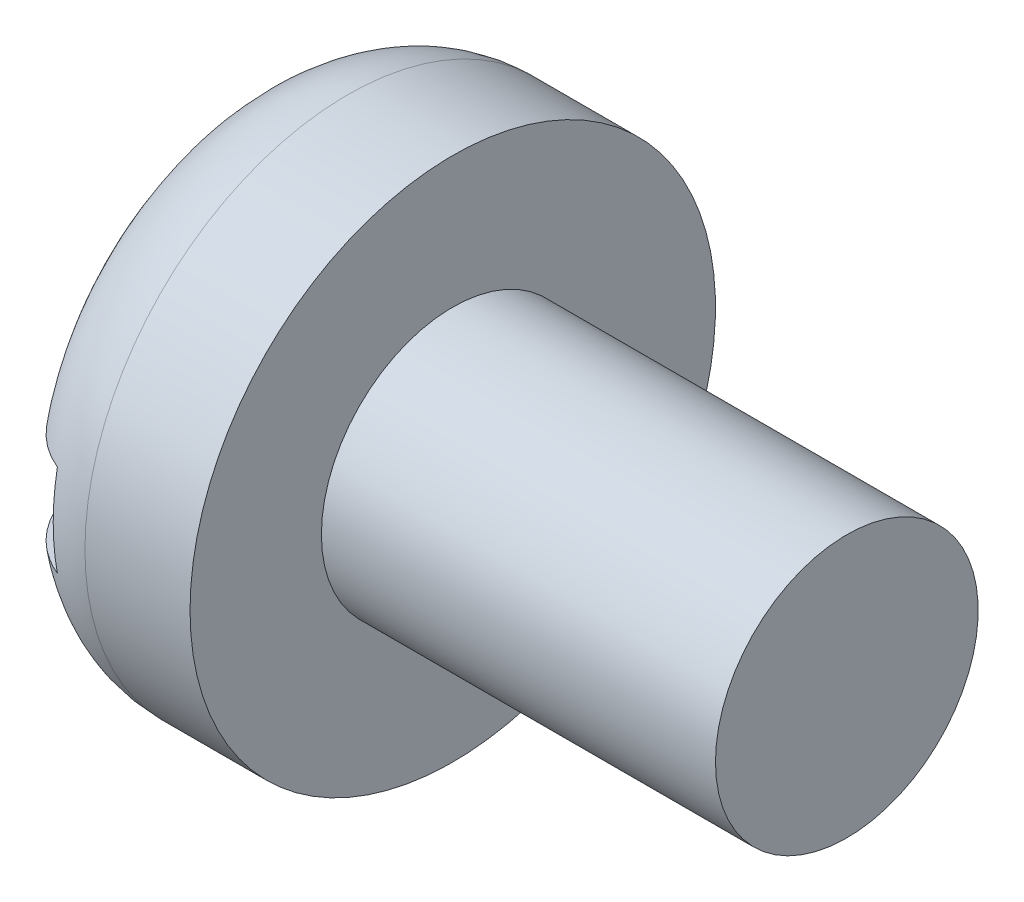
SolidWorks part; units mm, degrees
ref_plane "Plane1" through (0, 0, 0) normal (0, 0, 1) x (1, 0, 0)
ref_plane "Plane2" through (0, 0, 0) normal (0, 1, 0) x (1, 0, 0)
ref_plane "Plane3" through (0, 0, 0) normal (1, 0, 0) x (0, 0, -1)
revolve "Base-Revolve" add sketch "BodySke" angle 360 about L2
sketch "BodySke" plane through (0, 0, 0) normal (0, 0, 1) x (1, 0, 0)
  line L0 (1.6, 1) -> (1.6, 2)
  line L1 (0, 0) -> (0, 1.2)
  line L2 (-25.4, 0) -> (127, 0) construction
  line L3 (4.6, 0) -> (0, 0)
  line L4 (1.6, 1) -> (4.6, 1)
  line L5 (4.6, 1) -> (4.6, 0)
  line L6 (0.8, 2) -> (1.6, 2)
  line L7 (1.6, -1) -> (4.6, -1) construction
  line L8 (0, -2) -> (1.6, -2) construction
  line L9 (2, 2.5875) -> (2, -6.9375) construction
  line L10 (1.6, 6.35) -> (1.6, -3.175) construction
  arc A0 (0, 1.2) -> (0.8, 2) centre (0.8, 1.2) cw
  point P15 (0, 2)
  dimension "Head_fillet_rad" = 0.8
  dimension "Head_ht" = 1.6
  dimension "Diameter" = 2
  dimension "Length" = 3
  dimension "Head_dia" = 4
  dimension "Advance" = 0.4
  dimension "Thread_nom" = 3
sketch "Sketch2" plane through (0, 0, 0) normal (1, 0, 0) x (0, 0, -1)
  line L0 (2, -0.35) -> (-2, -0.35)
  line L1 (2, -0.35) -> (2, 0.35)
  line L2 (-2, 0.35) -> (2, 0.35)
  line L3 (-2, 0.35) -> (-2, -0.35)
  dimension "D1" = 4
  dimension "D2" = 2
  dimension "Slot_width" = 0.7
  dimension "D3" = 0.35
extrude "Slot" cut sketch "Sketch2" along normal blind 0.5
sketch "ThdSchSke" plane through (0, 0, 0) normal (0, 0, 1) x (1, 0, 0)
  line L0 (2, -0.774) -> (1.8418, -1)
  line L1 (2, -0.774) -> (2.1582, -1)
  line L2 (2.1582, -1) -> (2.1582, -1.25)
  line L3 (-3.175, 0) -> (5.1513, 0) construction
  line L5 (2.1582, -1.25) -> (1.8418, -1.25)
  line L6 (1.8418, -1.25) -> (1.8418, -1)
  dimension "Thread_minor" = 1.548
  dimension "Diameter" = 2
  dimension "Start" = 2
  dimension "SideAngle" = 55
  dimension "VeeAngle" = 70
  dimension "Overcut" = 2.5
revolve "ThreadSchematic" [suppressed] cut sketch "ThdSchSke" angle 360 about L3
pattern_linear "ThdSchPat" [suppressed]
equation "\"D1@Sketch2\" = \"Head_dia@BodySke\""
equation "\"D2@Sketch2\" = \"D1@Sketch2\" / 2"
equation "\"D3@Sketch2\" = \"Slot_width@Sketch2\" / 2"
equation "\"Thread_length@ThreadCosmetic\" = ((sgn( (\"Length@BodySke\" - \"Advance@BodySke\" ) - \"Thread_nom@BodySke\" )-1)*( (\"Length@BodySke\" - \"Advance@BodySke\" ) - \"Thread_nom@BodySke\" ))/-2+ \"Thread_nom@BodySke\""
equation "\"Thread_minor@ThdSchSke\" = \"Thread_minor@ThreadCosmetic\""
equation "\"Diameter@ThdSchSke\" = \"Diameter@BodySke\""
equation "\"Overcut@ThdSchSke\" = \"Diameter@BodySke\" * 1.25"
equation "\"Start@ThdSchSke\" = \"Head_ht@BodySke\" + \"Length@BodySke\" - \"Thread_length@ThreadCosmetic\"  '---Non-countersunk---"
equation "\"Num_threads@ThdSchPat\" = int( \"Thread_length@ThreadCosmetic\" / \"Advance@BodySke\" + 0.999 )  + 1"
equation "\"Advance@ThdSchPat\" = \"Thread_length@ThreadCosmetic\" /  (\"Num_threads@ThdSchPat\" - 1) 'relax it"
